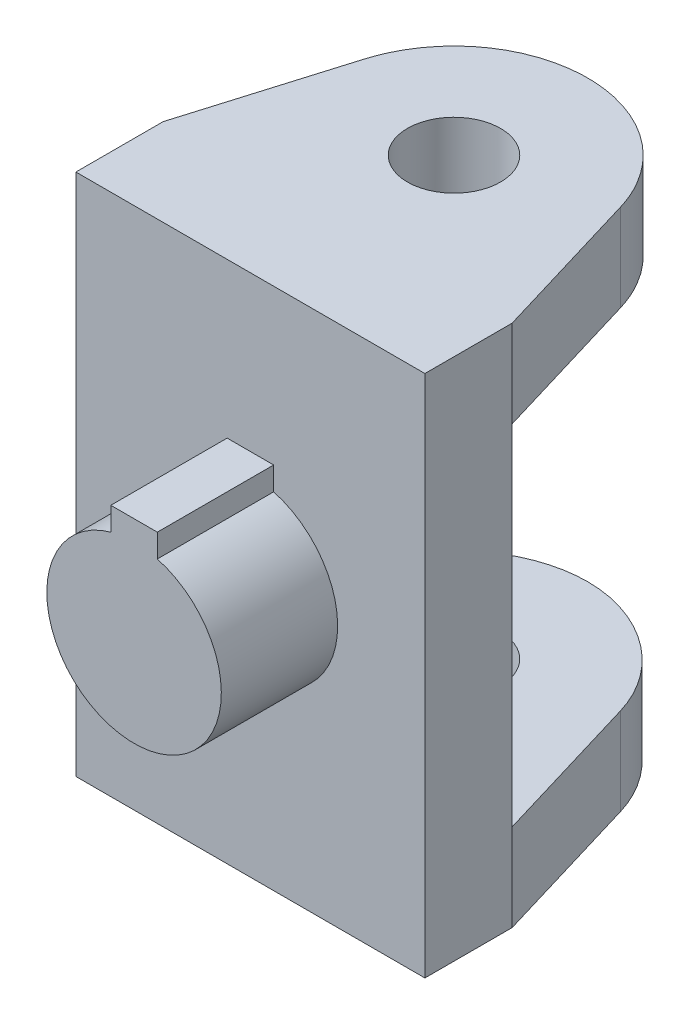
SolidWorks part; units mm, degrees
ref_plane "Front Plane" through (0, 0, 0) normal (0, 0, 1) x (1, 0, 0)
ref_plane "Top Plane" through (0, 0, 0) normal (0, 1, 0) x (1, 0, 0)
ref_plane "Right Plane" through (0, 0, 0) normal (1, 0, 0) x (0, 0, -1)
ref_plane "Plane1" through (0, 0, 3.9798) normal (0, 0, 1) x (1, 0, 0)
sketch "Sketch1" plane through (0, 0, 3.9798) normal (0, 0, 1) x (1, 0, 0)
  line L0 (11.0164, -14.9628) -> (11.0164, 15.0372)
  line L1 (11.0164, 15.0372) -> (-11.0164, 15.0372)
  line L2 (-11.0164, 15.0372) -> (-11.0164, -14.9628)
  line L3 (-11.0164, -14.9628) -> (11.0164, -14.9628)
extrude "Boss-Extrude1" add sketch "Sketch1" against normal blind 13.2997
sketch "Sketch2" plane through (0, 15.0372, 0) normal (0, 1, 0) x (-1, 0, 0)
  line L0 (-15, 3.9798) -> (15, 3.9798)
  spline S0 degree 3 poles (11.0164, -9.3199) (12.3443, -4.8867) (13.6722, -0.4534) (15, 3.9798) knots 0 0 0 0 1 1 1 1
  spline S1 degree 3 poles (-11.0164, -9.3199) (-11.0164, -9.3199) (-11.0164, -9.3199) (-10.3066, -11.6899) (-8.8513, -13.7678) (-4.563, -16.9599) (-1.701, -17.7507) (3.7842, -17.1964) (6.2406, -16.0343) (9.4692, -12.8208) (10.4673, -11.1534) (11.0164, -9.3199) (11.0164, -9.3199) (11.0164, -9.3199) knots 0 0 0 0 0 0 3.833243 3.833243 8.282876 8.282876 12.375118 12.375118 15.340615 15.340615 15.340615 15.340615 15.340615 15.340615
  spline S2 degree 3 poles (-15, 3.9798) (-13.6721, -0.4534) (-12.3443, -4.8867) (-11.0164, -9.3199) knots 0 0 0 0 1 1 1 1
extrude "Boss-Extrude2" add sketch "Sketch2" along normal blind 7.5
sketch "Sketch3" plane through (11.0164, 0, 0) normal (1, 0, 0) x (0, 0, -1)
  line L0 (-3.9798, -14.9628) -> (-3.9798, 15.0372)
  spline S0 degree 3 poles (9.3199, 15.0372) (4.8867, 15.0372) (0.4534, 15.0372) (-3.9798, 15.0372) knots 0 0 0 0 1 1 1 1
  spline S1 degree 3 poles (9.3199, -14.9628) (9.3199, -4.9628) (9.3199, 5.0372) (9.3199, 15.0372) knots 0 0 0 0 1 1 1 1
  spline S2 degree 3 poles (9.3199, -14.9628) (4.8867, -14.9628) (0.4534, -14.9628) (-3.9798, -14.9628) knots 0 0 0 0 1 1 1 1
extrude "Boss-Extrude3" add sketch "Sketch3" along normal blind 3.9836
sketch "Sketch4" plane through (-11.0164, 0, 0) normal (-1, 0, 0) x (0, 0, 1)
  line L0 (3.9798, 15.0372) -> (3.9798, -14.9628)
  spline S0 degree 3 poles (-9.3199, -14.9628) (-4.8867, -14.9628) (-0.4534, -14.9628) (3.9798, -14.9628) knots 0 0 0 0 1 1 1 1
  spline S1 degree 3 poles (-9.3199, 15.0372) (-9.3199, 5.0372) (-9.3199, -4.9628) (-9.3199, -14.9628) knots 0 0 0 0 1 1 1 1
  spline S2 degree 3 poles (-9.3199, 15.0372) (-4.8867, 15.0372) (-0.4534, 15.0372) (3.9798, 15.0372) knots 0 0 0 0 1 1 1 1
extrude "Boss-Extrude4" add sketch "Sketch4" along normal blind 3.9836
sketch "Sketch5" plane through (0, 0, 3.9798) normal (0, 0, 1) x (1, 0, 0)
  line L0 (15, -14.9628) -> (-15, -14.9628)
  spline S0 degree 3 poles (-15, 0.0372) (-15, -4.9628) (-15, -9.9628) (-15, -14.9628) knots 0 0 0 0 1 1 1 1
  spline S1 degree 3 poles (-15, 22.5372) (-15, 15.0372) (-15, 7.5372) (-15, 0.0372) knots 0 0 0 0 1 1 1 1
  spline S2 degree 3 poles (15, 22.5372) (5, 22.5372) (-5, 22.5372) (-15, 22.5372) knots 0 0 0 0 1 1 1 1
  spline S3 degree 3 poles (15, 0.0372) (15, 7.5372) (15, 15.0372) (15, 22.5372) knots 0 0 0 0 1 1 1 1
  spline S4 degree 3 poles (15, -14.9628) (15, -9.9628) (15, -4.9628) (15, 0.0372) knots 0 0 0 0 1 1 1 1
extrude "Boss-Extrude5" add sketch "Sketch5" along normal blind 7.5
sketch "Sketch6" plane through (0, 0, -9.3199) normal (0, 0, -1) x (-1, 0, 0)
  line L0 (-15, -14.9628) -> (15, -14.9628)
  spline S0 degree 3 poles (-15, -14.9628) (-15, -4.9628) (-15, 5.0372) (-15, 15.0372) knots 0 0 0 0 1 1 1 1
  spline S1 degree 3 poles (15, 15.0372) (15, 5.0372) (15, -4.9628) (15, -14.9628) knots 0 0 0 0 1 1 1 1
  spline S2 degree 3 poles (15, 15.0372) (5, 15.0372) (-5, 15.0372) (-15, 15.0372) knots 0 0 0 0 1 1 1 1
extrude "Cut-Extrude1" cut sketch "Sketch6" against normal blind 13.2997
sketch "Sketch7" plane through (0, -14.9628, 0) normal (0, -1, 0) x (1, 0, 0)
  spline S0 degree 3 poles (-15, 11.4798) (-15, 8.9798) (-15, 6.4798) (-15, 3.9798) knots 0 0 0 0 1 1 1 1
  spline S1 degree 3 poles (-15, 11.4798) (-5, 11.4798) (5, 11.4798) (15, 11.4798) knots 0 0 0 0 1 1 1 1
  spline S2 degree 3 poles (15, 11.4798) (15, 8.9798) (15, 6.4798) (15, 3.9798) knots 0 0 0 0 1 1 1 1
  spline S3 degree 3 poles (15, 3.9798) (13.6722, -0.4534) (12.3443, -4.8867) (11.0164, -9.3199) knots 0 0 0 0 1 1 1 1
  spline S4 degree 3 poles (11.0164, -9.3199) (9.596, -14.0623) (4.8868, -17.5297) (-4.9319, -17.5107) (-9.596, -14.0623) (-11.0164, -9.3199) knots 0 0 0 0 0.5 0.5 1 1 1 1
  spline S5 degree 3 poles (-11.0164, -9.3199) (-12.3443, -4.8867) (-13.6722, -0.4534) (-15, 3.9798) knots 0 0 0 0 1 1 1 1
extrude "Boss-Extrude6" add sketch "Sketch7" along normal blind 7.5
hole_wizard "Ø8.0 (8) Diameter Hole1" positions "Sketch11" profile "Sketch10" hole size "Ø8.0" standard "ANSI Metric"
sketch "Sketch11" plane through (0, -22.4628, 0) normal (0, -1, 0) x (-1, 0, 0)
  point P0 (0, 6.0202)
sketch "Sketch10" plane through (0, -22.4628, -6.0202) normal (1, 0, 0) x (0, 0, -1)
  line L0 (0, 0) -> (0, 7.5)
  line L1 (0, 7.5) -> (4, 7.5)
  line L2 (4, 7.5) -> (4, 0)
  line L5 (4, 0) -> (0, 0)
  line L11 (0, -6.35) -> (0, 107.95) construction
  dimension "Thru Hole Dia." = 8
  dimension "Thru Hole Depth" = 7.5
hole_wizard "Ø8.0 (8) Diameter Hole2" positions "Sketch13" profile "Sketch12" hole size "Ø8.0" standard "ANSI Metric"
sketch "Sketch13" plane through (0, 22.5372, 0) normal (0, 1, 0) x (1, 0, 0)
  point P0 (0, 6.0202)
sketch "Sketch12" plane through (0, 22.5372, -6.0202) normal (1, 0, 0) x (0, 0, 1)
  line L0 (0, 0) -> (0, 45)
  line L1 (0, 45) -> (4, 45)
  line L2 (4, 45) -> (4, 0)
  line L5 (4, 0) -> (0, 0)
  line L11 (0, -6.35) -> (0, 107.95) construction
  dimension "Thru Hole Dia." = 8
  dimension "Thru Hole Depth" = 45
sketch "Sketch14" plane through (0, 0, 11.4798) normal (0, 0, 1) x (1, 0, 0)
  line L0 (0, 0) -> (0, 11.4944) construction
  line L1 (-2, 7.2284) -> (-2, 9.2284)
  line L2 (-2, 9.2284) -> (2, 9.2284)
  line L3 (2, 9.2284) -> (2, 7.2284)
  arc A0 (-2, 7.2284) -> (2, 7.2284) centre (0, 0) ccw
  point P6 (0, 9.2284)
  dimension "D1" = 7.5
  dimension "D2" = 2
  dimension "D3" = 4
extrude "Boss-Extrude8" add sketch "Sketch14" along normal blind 10
